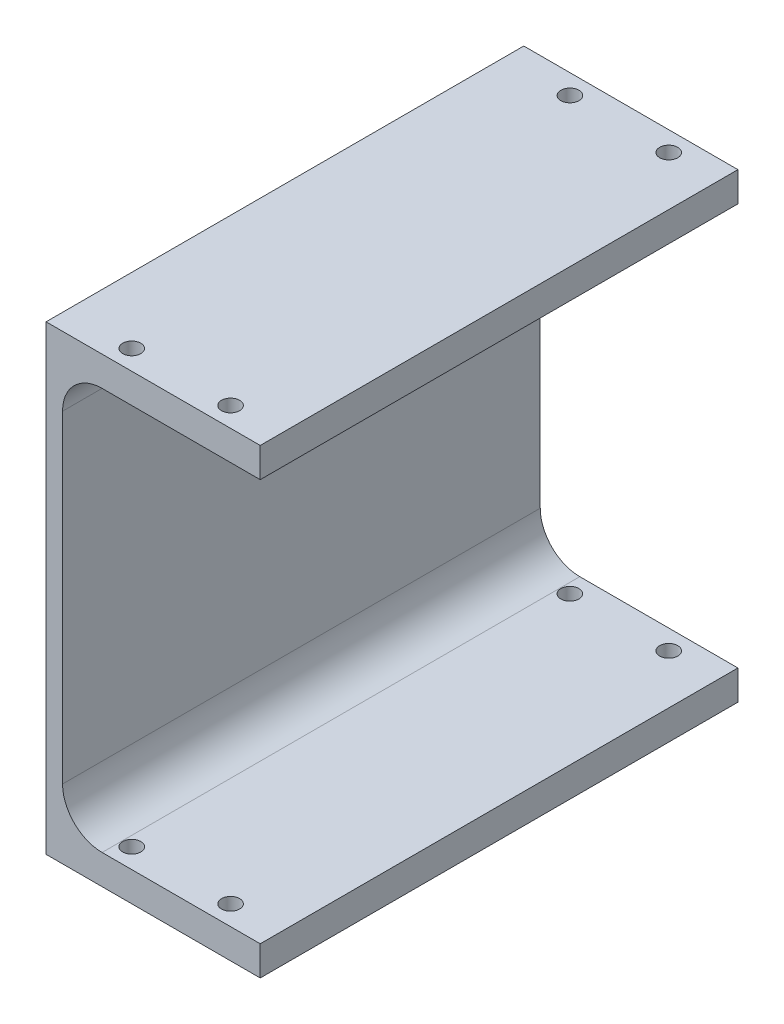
SolidWorks part; units mm, degrees
ref_plane "Face" through (0, 0, 0) normal (0, 0, 1) x (1, 0, 0)
ref_plane "Dessus" through (0, 0, 0) normal (0, 1, 0) x (1, 0, 0)
ref_plane "Droite" through (0, 0, 0) normal (1, 0, 0) x (0, 0, -1)
sketch "Esquisse1" plane through (0, 0, 0) normal (0, 0, 1) x (1, 0, 0)
  line L0 (65, -61) -> (65, -70)
  line L1 (65, 70) -> (0, 70)
  line L2 (65, 70) -> (65, 61)
  line L3 (65, -70) -> (0, -70)
  line L4 (0, 70) -> (0, -70)
  line L5 (65, 61) -> (5, 61)
  line L7 (65, -61) -> (5, -61)
  line L8 (5, 61) -> (5, -61)
  dimension "D1" = 140
  dimension "D2" = 65
  dimension "D3" = 5
  dimension "D4" = 9
extrude "Extrusion1" add sketch "Esquisse1" along normal mid plane 145
fillet "Congé1" radius 12 2 edges at (5, 61, 0) (5, -61, 0)
hole_wizard "Dégagement M51" positions "Esquisse3" profile "Esquisse2" hole size "M5" standard "Ansi Métrique"
sketch "Esquisse3" plane through (0, 70, 0) normal (0, 1, 0) x (-1, 0, 0)
  line L0 (-50, 66.5) -> (-20, 66.5) construction
  line L1 (-20, -66.5) -> (-50, -66.5) construction
  line L3 (-65, 72.5) -> (0, 72.5) construction
  line L4 (-65, -72.5) -> (0, -72.5) construction
  line L5 (0, 72.5) -> (0, -72.5) construction
  point P0 (-20, 66.5)
  point P1 (-20, -66.5)
  point P2 (-50, -66.5)
  point P3 (-50, 66.5)
  dimension "D1" = 6
  dimension "D2" = 6
  dimension "D3" = 30
  dimension "D4" = 20
sketch "Esquisse2" plane through (20, 70, 66.5) normal (1, 0, 0) x (0, 0, 1)
  line L0 (0, 0) -> (0, 140)
  line L1 (0, 140) -> (2.75, 140)
  line L2 (2.75, 140) -> (2.75, 0)
  line L5 (2.75, 0) -> (0, 0)
  line L11 (0, -6.35) -> (0, 107.95) construction
  dimension "Diamètre du perçage jusqu'au prochain" = 5.5
  dimension "Profondeur du perçage jusqu'au prochain" = 140
sketch "Esquisse4" plane through (0, 0, 0) normal (0, 0, 1) x (1, 0, 0)
  line L1 (0, 70) -> (0, -70) construction
  line L2 (0, -70) -> (65, -70) construction
  circle A0 centre (15, -85) radius 5
  dimension "D1" = 10
  dimension "D3" = 15
  dimension "D2" = 15
extrude "Extrusion2" add sketch "Esquisse4" along normal mid plane 100
